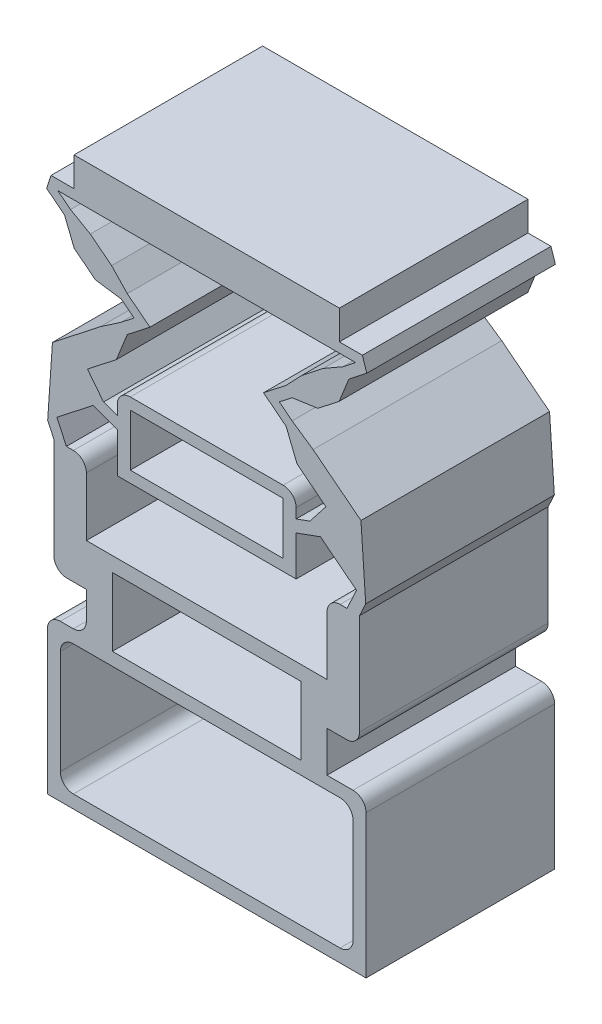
SolidWorks part; units mm, degrees
ref_plane "前视基准面" through (0, 0, 0) normal (0, 0, 1) x (1, 0, 0)
ref_plane "上视基准面" through (0, 0, 0) normal (0, 1, 0) x (1, 0, 0)
ref_plane "右视基准面" through (0, 0, 0) normal (1, 0, 0) x (0, 0, -1)
other "Configuration Table"
sketch "草图1" plane through (0, 0, 0) normal (0, 0, 1) x (1, 0, 0)
  line L0 (2.75, 5.2) -> (3.1729, 5.3539)
  line L1 (-3.7, -1.4) -> (3.7, -1.4)
  line L2 (-3.7, -1.4) -> (-3.7, 1.4)
  line L4 (3.7, -1.4) -> (3.7, 0.1)
  line L5 (-3.7, -1.4) -> (3.7, 1.4) construction
  line L6 (-3.7, 1.4) -> (3.7, -1.4) construction
  line L7 (-2.75, 5.2) -> (2.75, 5.2)
  line L8 (-2.75, 5.2) -> (-2.75, 3.6)
  line L9 (-2.75, 3.6) -> (2.75, 3.6)
  line L10 (2.75, 4.8275) -> (2.75, 3.6)
  line L11 (-2.75, 5.2) -> (2.75, 3.6) construction
  line L12 (-2.75, 3.6) -> (2.75, 5.2) construction
  line L14 (3.7, 0.1) -> (4.7, 0.1)
  line L17 (4.0365, 6.4558) -> (3.1729, 5.3539)
  line L19 (4.0365, 6.4558) -> (5.8467, 5.0369)
  line L33 (2.75, 5.2) -> (2.75, 4.8275) construction
  line L34 (3.1729, 5.3539) -> (3.4974, 5.0996) construction
  line L37 (4.7, 3.6) -> (4.7, 0.1)
  line L38 (-3.7, 1.4) -> (3.7, 1.4)
  line L39 (3.7, 1.4) -> (3.7, 0.1) construction
  line L40 (0, 9.062) -> (0, -4.0269) construction
  line L41 (2.75, 4.8275) -> (3.4974, 5.0996)
  line L48 (3.4974, 5.0996) -> (4.6074, 4.2295)
  line L51 (4.3138, 3.6) -> (4.6074, 4.2295)
  line L53 (4.8902, 4.0078) -> (4.9831, 3.935)
  line L55 (4.6074, 4.2295) -> (4.8902, 4.0078) construction
  line L56 (4.3138, 3.6) -> (4.7, 3.6) construction
  line L57 (3.7, 1.4) -> (3.7, 3.6)
  line L58 (3.7, 3.6) -> (4.3138, 3.6)
  line L59 (4.7, 3.6) -> (4.8902, 4.0078)
  line L60 (4.9831, 3.935) -> (5.8467, 5.0369)
  point P0 (0, 0)
  point P6 (0, 4.4)
  dimension "D1" = 7.4
  dimension "D2" = 2.8
  dimension "D3" = 5.5
  dimension "D4" = 1.6
  dimension "D5" = 1
  dimension "D6" = 0.45
  dimension "D7" = 0.45
  dimension "D8" = 0.35
  dimension "D9" = 3.5
  dimension "D10" = 1.4
  dimension "D11" = 0.35
  dimension "D12" = 2.2
  dimension "D13" = 65
  dimension "D14" = 2.2
  dimension "D15" = 2.3
  dimension "D16" = 110
extrude "凸台-拉伸1" add sketch "草图1" along normal blind 5.8
mirror "镜向1" about plane through (0, 0, 0) normal (1, 0, 0) of "凸台-拉伸1"
sketch "草图10" plane through (0, 0, 5.8) normal (0, 0, 1) x (1, 0, 0)
  line L0 (-2.75, 3.6) -> (2.75, 3.6) construction
  line L1 (-2.9, -1.05) -> (2.9, -1.05)
  line L2 (-2.9, -1.05) -> (-2.9, 1.05)
  line L3 (-2.9, 1.05) -> (2.9, 1.05)
  line L4 (2.9, -1.05) -> (2.9, 1.05)
  line L5 (-2.9, -1.05) -> (2.9, 1.05) construction
  line L6 (-2.9, 1.05) -> (2.9, -1.05) construction
  line L7 (-2.35, 5.55) -> (2.35, 5.55)
  line L8 (-2.35, 5.55) -> (-2.35, 3.95)
  line L9 (-2.35, 3.95) -> (2.35, 3.95)
  line L10 (2.35, 5.55) -> (2.35, 3.95)
  point P0 (0, 0)
  point P10 (0, 5.55)
  dimension "D1" = 5.8
  dimension "D2" = 2.1
  dimension "D3" = 4.7
  dimension "D4" = 1.6
  dimension "D5" = 0.35
extrude "切除-拉伸3" cut sketch "草图10" against normal through all
sketch "草图11" plane through (0, 0, 5.8) normal (0, 0, 1) x (1, 0, 0)
  line L0 (-2.35, 5.2) -> (-2.75, 5.2)
  line L1 (-2.75, 5.2) -> (-2.75, 5.9)
  line L2 (-2.75, 5.9) -> (2.75, 5.9)
  line L3 (2.75, 5.9) -> (2.75, 5.2)
  line L4 (2.75, 3.6) -> (2.75, 4.8275) construction
  line L5 (2.75, 5.2) -> (2.35, 5.2)
  line L6 (2.35, 5.2) -> (2.35, 5.55)
  line L7 (2.35, 5.55) -> (-2.35, 5.55)
  line L8 (-2.35, 5.55) -> (-2.35, 5.2)
  line L9 (-2.35, 3.95) -> (2.35, 3.95) construction
  dimension "D1" = 0.35
  dimension "D2" = 1.6
extrude "凸台-拉伸2" add sketch "草图11" against normal up to surface (5.8 mm away)
fillet "圆角1" radius 0.4 2 edges at (-2.75, 5.9, 2.9) (2.75, 5.9, 2.9)
sketch "草图13" plane through (0, 0, 5.8) normal (0, 0, 1) x (1, 0, 0)
  line L4 (-4.8902, 4.0078) -> (-4.7617, 5.8873)
  line L8 (-5.8467, 5.0369) -> (-4.0365, 6.4558) construction
  line L9 (-4.7617, 5.8873) -> (-5.8467, 5.0369)
  line L10 (-5.8467, 5.0369) -> (-4.9831, 3.935)
  line L11 (-4.9831, 3.935) -> (-4.8902, 4.0078)
  line L12 (4.8902, 4.0078) -> (4.9831, 3.935)
  line L13 (4.9831, 3.935) -> (5.8467, 5.0369)
  line L14 (5.8467, 5.0369) -> (4.7617, 5.8873)
  line L15 (5.8467, 5.0369) -> (4.0365, 6.4558) construction
  line L16 (4.7617, 5.8873) -> (4.8902, 4.0078)
  dimension "D1" = 48
  dimension "D2" = 48
extrude "切除-拉伸4" cut sketch "草图13" against normal through all
sketch "草图14" plane through (0, 0, 5.8) normal (0, 0, 1) x (1, 0, 0)
  line L0 (2.9, -1.05) -> (2.9, 1.05) construction
  line L1 (-2.9, 1.05) -> (2.9, 1.05)
  line L2 (-2.9, 1.05) -> (-2.9, 0.95)
  line L3 (-2.9, 0.95) -> (2.9, 0.95)
  line L4 (2.9, 1.05) -> (2.9, 0.95)
  line L5 (3.7, -1.4) -> (3.7, 0.1) construction
  line L6 (-3.7, -1.4) -> (3.7, -1.4)
  line L7 (-3.7, -1.4) -> (-3.7, -1.5)
  line L8 (-3.7, -1.5) -> (3.7, -1.5)
  line L9 (3.7, -1.4) -> (3.7, -1.5)
  dimension "D1" = 0.1
  dimension "D2" = 0.1
extrude "凸台-拉伸4" add sketch "草图14" against normal up to surface (5.8 mm away)
sketch "草图15" plane through (0, 0, 5.8) normal (0, 0, 1) x (1, 0, 0)
  line L0 (2.9, -1.05) -> (2.9, 0.95) construction
  line L1 (-2.9, -1.05) -> (2.9, -1.05)
  line L2 (-2.9, -1.05) -> (-2.9, -1.15)
  line L3 (-2.9, -1.15) -> (2.9, -1.15)
  line L4 (2.9, -1.05) -> (2.9, -1.15)
  dimension "D1" = 0.1
extrude "切除-拉伸5" cut sketch "草图15" against normal through all
sketch "草图12" plane through (0, 0, 5.8) normal (0, 0, 1) x (1, 0, 0)
  line L0 (-4.0365, 6.4558) -> (-1.9902, 8.0597) construction
  line L1 (-4.7617, 5.8873) -> (-4.0365, 6.4558) construction
  line L2 (-1.9902, 8.0597) -> (-4.8236, 10.2805) construction
  line L3 (-2.6269, 7.7513) -> (-2.2334, 8.0597)
  line L5 (-2.6577, 7.7906) -> (-2.6269, 7.7513) construction
  line L6 (-2.8736, 8.0533) -> (-2.6269, 8.3682) construction
  line L7 (-4.0365, 6.4558) -> (-3.1729, 5.3539) construction
  line L8 (-2.4418, 7.5151) -> (-2.1642, 7.161) construction
  line L18 (-2.1642, 7.161) -> (-2.6577, 7.7906) construction
  line L19 (-2.1642, 7.161) -> (-3.6664, 5.9835) construction
  line L20 (-4.0365, 6.4558) -> (-1.9902, 8.0597) construction
  line L53 (-2.2334, 8.0597) -> (-2.6269, 8.3682)
  line L54 (-2.4418, 7.5151) -> (-1.7471, 8.0597)
  line L55 (-1.7471, 8.0597) -> (-2.4418, 8.6043)
  line L56 (-4.7617, 5.8873) -> (-4.7434, 6.1558)
  line L57 (-4.7434, 6.1558) -> (-2.6577, 7.7906) construction
  line L58 (-4.8902, 4.0078) -> (-4.7617, 5.8873) construction
  line L59 (-4.372, 9.736) -> (-5.0667, 10.2805) construction
  line L60 (-2.4418, 7.5151) -> (-2.6269, 7.7513) construction
  line L61 (-2.6269, 8.3682) -> (-2.4418, 8.6043) construction
  line L62 (-2.8736, 8.0533) -> (-2.3801, 8.683) construction
  line L63 (-2.3801, 8.683) -> (-4.1252, 10.0508) construction
  line L64 (-2.8736, 8.0533) -> (-4.6187, 9.4212) construction
  line L65 (-4.6187, 9.4212) -> (-4.1252, 10.0508) construction
  line L66 (-5.0667, 10.2805) -> (-5.0667, 10.5805) construction
  line L67 (-4.8236, 10.2805) -> (4.8798, 10.2805) construction
  line L68 (-4.1869, 9.9721) -> (-4.5804, 10.2805)
  line L69 (-4.5804, 10.2805) -> (-4.0804, 10.2805)
  line L70 (-4.0804, 10.2805) -> (-4.0804, 11.4805) construction
  line L74 (-5.0667, 10.5805) -> (-4.0804, 10.5805) construction
  line L75 (-2.3801, 8.683) -> (-2.4418, 8.6043) construction
  line L76 (-4.7617, 5.8873) -> (-4.0365, 6.4558)
  line L77 (-4.0365, 6.4558) -> (-3.6664, 5.9835)
  line L78 (-4.6187, 9.4212) -> (-4.372, 9.736) construction
  line L79 (-4.1869, 9.9721) -> (-4.1252, 10.0508) construction
  line L80 (-4.0804, 10.5805) -> (-4.0804, 11.4805)
  line L81 (0, 7.7035) -> (0, 13.757) construction
  line L105 (4.0365, 6.4558) -> (2.1476, 7.9363) construction
  line L106 (2.1476, 7.9363) -> (4.8798, 10.2805) construction
  line L107 (-4.7434, 6.1558) -> (-3.2712, 7.3098)
  line L108 (-3.2712, 7.3098) -> (-2.6269, 7.7513)
  line L109 (-3.6664, 5.9835) -> (-2.7776, 6.6802)
  line L110 (-2.7776, 6.6802) -> (-2.4418, 7.5151)
  line L111 (-2.6269, 8.3682) -> (-3.4189, 8.4807)
  line L112 (-3.4189, 8.4807) -> (-4.0734, 8.9938)
  line L113 (-4.0734, 8.9938) -> (-4.372, 9.736)
  line L114 (-2.4418, 8.6043) -> (-2.9254, 9.1104)
  line L115 (-2.9254, 9.1104) -> (-3.5799, 9.6234)
  line L116 (-3.5799, 9.6234) -> (-4.1869, 9.9721)
  line L117 (-4.372, 9.736) -> (-4.9229, 10.1678)
  line L118 (-4.9229, 10.1678) -> (-4.7881, 10.5805)
  line L119 (-4.7881, 10.5805) -> (-4.0804, 10.5805)
  line L120 (-2.7776, 6.6802) -> (-3.2712, 7.3098) construction
  line L121 (-3.4189, 8.4807) -> (-2.9254, 9.1104) construction
  line L122 (-4.0734, 8.9938) -> (-3.5799, 9.6234) construction
  line L148 (4.7617, 5.8873) -> (4.0365, 6.4558) construction
  line L149 (4.0804, 10.5805) -> (4.0804, 11.4805)
  line L150 (4.1869, 9.9721) -> (4.5804, 10.2805)
  line L151 (4.5804, 10.2805) -> (4.0804, 10.2805)
  line L152 (4.7881, 10.5805) -> (4.0804, 10.5805)
  line L153 (4.9229, 10.1678) -> (4.7881, 10.5805)
  line L154 (4.372, 9.736) -> (4.9229, 10.1678)
  line L155 (4.0734, 8.9938) -> (4.372, 9.736)
  line L156 (3.5799, 9.6234) -> (4.1869, 9.9721)
  line L157 (2.9254, 9.1104) -> (3.5799, 9.6234)
  line L158 (3.4189, 8.4807) -> (4.0734, 8.9938)
  line L159 (2.6269, 8.3682) -> (3.4189, 8.4807)
  line L160 (2.4418, 8.6043) -> (2.9254, 9.1104)
  line L161 (1.7471, 8.0597) -> (2.4418, 8.6043)
  line L162 (2.2334, 8.0597) -> (2.6269, 8.3682)
  line L163 (2.6269, 7.7513) -> (2.2334, 8.0597)
  line L164 (2.4418, 7.5151) -> (1.7471, 8.0597)
  line L165 (2.7776, 6.6802) -> (2.4418, 7.5151)
  line L166 (3.2712, 7.3098) -> (2.6269, 7.7513)
  line L167 (3.6664, 5.9835) -> (2.7776, 6.6802)
  line L168 (4.7434, 6.1558) -> (3.2712, 7.3098)
  line L169 (4.7617, 5.8873) -> (4.7434, 6.1558)
  line L170 (4.0365, 6.4558) -> (3.6664, 5.9835)
  line L171 (4.7617, 5.8873) -> (4.0365, 6.4558)
  line L172 (-4.0804, 11.4805) -> (4.0804, 11.4805)
  line L173 (-4.0804, 10.2805) -> (4.0804, 10.2805)
  dimension "D1" = 2.6
  dimension "D2" = 3.6
  dimension "D3" = 0.15
  dimension "D4" = 2.4
  dimension "D5" = 0.5
  dimension "D6" = 0.15
  dimension "D7" = 0.5
  dimension "D8" = 0.5
  dimension "D9" = 0.8
  dimension "D10" = 0.2
  dimension "D11" = 0.8
  dimension "D12" = 0.15
  dimension "D13" = 0.15
  dimension "D14" = 3.6
  dimension "D15" = 60
  dimension "D16" = 0.5
  dimension "D17" = 60
  dimension "D18" = 0.15
  dimension "D19" = 60
  dimension "D20" = 0.7
  dimension "D21" = 0.3
  dimension "D22" = 110
  dimension "D23" = 0.9
  dimension "D24" = 0.55
extrude "凸台-拉伸3" add sketch "草图12" against normal up to surface (5.8 mm away)
sketch "草图16" plane through (0, 0, 5.8) normal (0, 0, 1) x (1, 0, 0)
  line L0 (-4.9, -1.15) -> (4.9, -1.15)
  line L1 (-2.9, -1.15) -> (2.9, -1.15) construction
  line L2 (4.9, -1.15) -> (4.9, -5.95)
  line L3 (4.9, -5.95) -> (-4.9, -5.95)
  line L4 (-4.9, -5.95) -> (-4.9, -1.15)
  line L5 (-4.5, -1.55) -> (4.5, -1.55)
  line L6 (4.5, -1.55) -> (4.5, -5.55)
  line L7 (4.5, -5.55) -> (-4.5, -5.55)
  line L8 (-4.5, -5.55) -> (-4.5, -1.55)
  point P4 (0, -5.95)
  dimension "D1" = 0.4
  dimension "D2" = 0.4
  dimension "D3" = 0.4
  dimension "D4" = 0.4
  dimension "D5" = 4
  dimension "D6" = 9
extrude "凸台-拉伸5" add sketch "草图16" against normal up to surface (5.8 mm away)
fillet "圆角2" radius 0.4 9 edges at (4.7, 0.1, 2.9) (-4.7, 0.1, 2.9) (-3.7, -1.15, 2.9) (4.9, -1.15, 2.9) (-4.9, -1.15, 2.9) (-4.5, -1.55, 2.9) (4.5, -1.55, 2.9) (4.5, -5.55, 2.9) (-4.5, -5.55, 2.9)
fillet "圆角3" radius 0.4 2 edges at (-3.7, 3.6, 2.9) (3.7, 3.6, 2.9)
sketch "草图17" plane through (0, 0, 0) normal (0, 0, -1) x (-1, 0, 0)
  line L5 (4.656, -5.7078) -> (-4.6452, -5.7078)
  line L6 (4.656, -5.7078) -> (4.656, -1.3757)
  line L7 (4.656, -1.3757) -> (-4.6452, -1.3757)
  line L8 (-4.6452, -5.7078) -> (-4.6452, -1.3757)
extrude "凸台-拉伸6" add sketch "草图17" against normal blind 0.3
